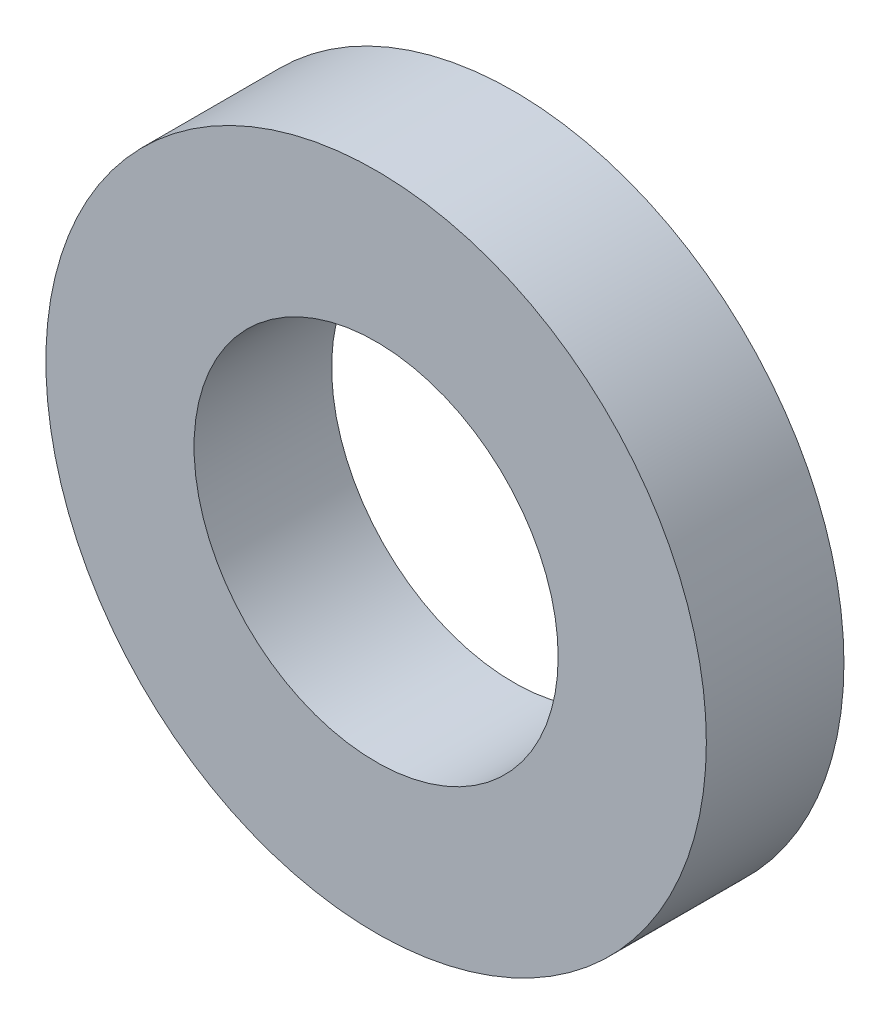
SolidWorks part; units mm, degrees
ref_plane "Front Plane" through (0, 0, 0) normal (0, 0, 1) x (1, 0, 0)
ref_plane "Top Plane" through (0, 0, 0) normal (0, 1, 0) x (1, 0, 0)
ref_plane "Right Plane" through (0, 0, 0) normal (1, 0, 0) x (0, 0, -1)
sketch "Sketch1" plane through (0, 0, 0) normal (0, 0, 1) x (1, 0, 0)
  circle A0 centre (0, 0) radius 2.1844
  circle A1 centre (0, 0) radius 3.9624
  dimension "ID" = 4.3688
  dimension "OD" = 7.9248
extrude "Extrude1" add sketch "Sketch1" against normal blind 1.651
